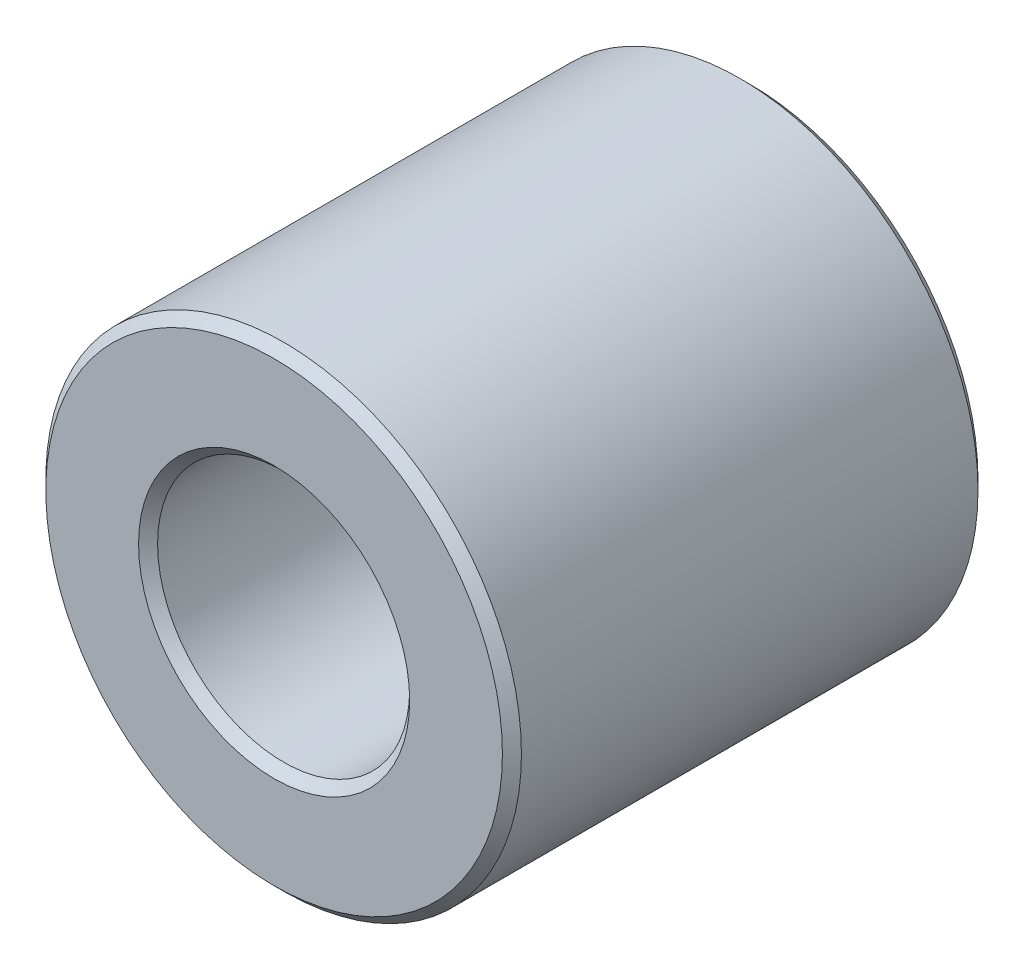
SolidWorks part; units mm, degrees
ref_plane "Front Plane" through (0, 0, 0) normal (0, 0, 1) x (1, 0, 0)
ref_plane "Top Plane" through (0, 0, 0) normal (0, 1, 0) x (1, 0, 0)
ref_plane "Right Plane" through (0, 0, 0) normal (1, 0, 0) x (0, 0, -1)
sketch "Sketch1" plane through (0, 0, 0) normal (0, 0, 1) x (1, 0, 0)
  circle A0 centre (0, 0) radius 5
  circle A1 centre (0, 0) radius 2.65
  dimension "D1" = 10
  dimension "D2" = 5.3
extrude "Boss-Extrude2" add sketch "Sketch1" along normal mid plane 10
chamfer "Chamfer3" distance 0.2 angle 45 4 edges at (5, 0, 5) (5, 0, -5) (2.65, 0, -5) (2.65, 0, 5)
